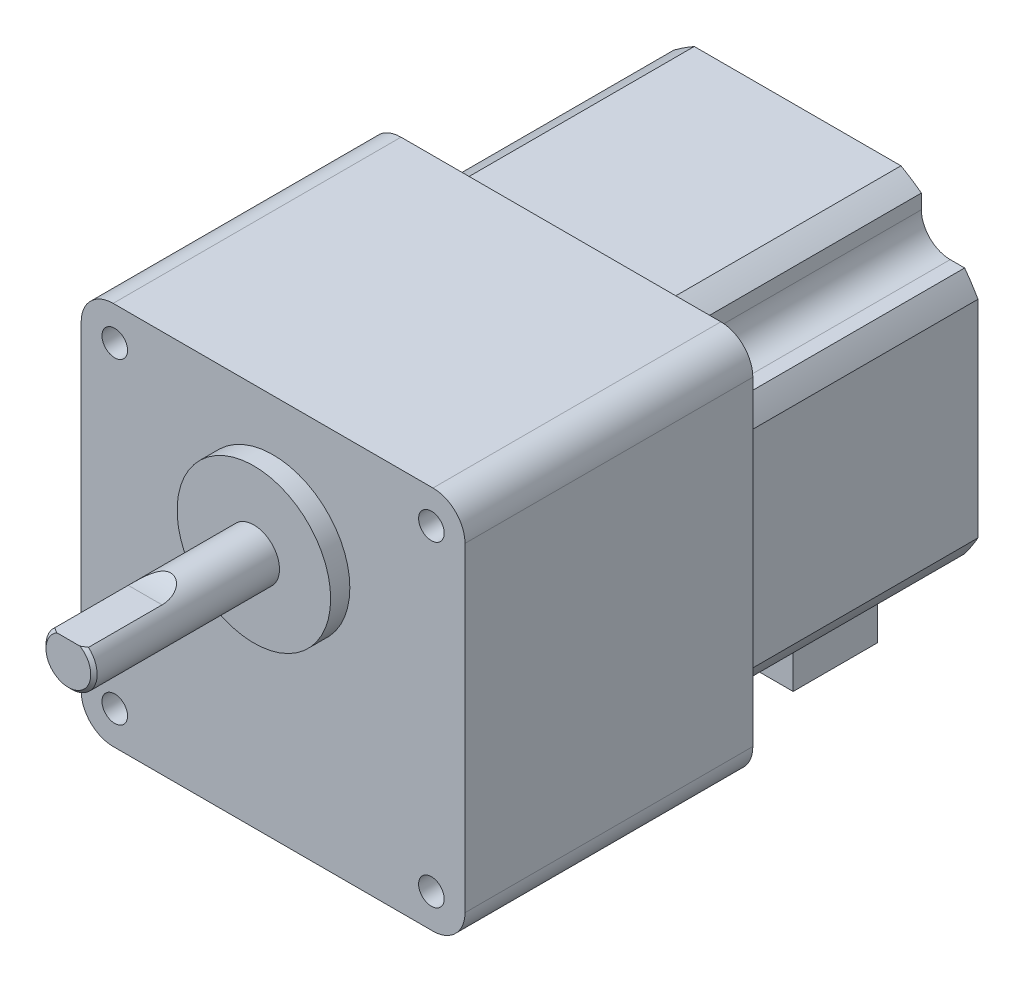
SolidWorks part; units mm, degrees
ref_plane "Front" through (0, 0, 0) normal (0, 0, 1) x (1, 0, 0)
ref_plane "Top" through (0, 0, 0) normal (0, 1, 0) x (1, 0, 0)
ref_plane "Right" through (0, 0, 0) normal (1, 0, 0) x (0, 0, -1)
sketch "Sketch1" plane through (0, 0, 0) normal (0, 0, 1) x (1, 0, 0)
  circle A0 centre (0, 0) radius 12
  dimension "D1" = 24
extrude "Extrude1" add sketch "Sketch1" along normal blind 3
sketch "Sketch2" plane through (0, 0, 3) normal (0, 0, 1) x (1, 0, 0)
  circle A0 centre (0, 0) radius 4
  dimension "D1" = 8
extrude "Extrude2" add sketch "Sketch2" along normal blind 29
chamfer "Chamfer1" distance 0.5 angle 45 1 edges at (4, 0, 32)
sketch "Sketch3" plane through (0, 0, 0) normal (1, 0, 0) x (0, 0, -1)
  line L0 (-32, 3) -> (-20, 3)
  line L1 (-32, 4) -> (-32, -4) construction
  line L2 (-20, 3) -> (-20, 11.5)
  line L3 (-20, 11.5) -> (-32, 11.5)
  line L4 (-32, 11.5) -> (-32, 3)
  line L5 (0, 0) -> (-32, 0) construction
  line L6 (-32, 4) -> (-7.262, 4) construction
  line L7 (-3, 4) -> (-31.5, 4) construction
  line L8 (-16, 4) -> (-16, 0) construction
  circle A0 centre (-20, 11.5) radius 8.5
  dimension "D1" = 3
  dimension "D2" = 12
  dimension "D3" = 16
extrude "Extrude3" cut sketch "Sketch3" against normal mid plane 10 contours A0 L3 L4 L0 | L3 A0 L2 | L2 A0 L3
sketch "Sketch4" plane through (0, 0, 0) normal (0, 0, -1) x (-1, 0, 0)
  line L0 (0, 0) -> (0, -10) construction
  line L1 (-25, -40) -> (25, -40)
  line L2 (-30, -35) -> (-30, 15)
  line L3 (-25, 20) -> (25, 20)
  line L4 (30, -35) -> (30, 15)
  line L5 (-30, -40) -> (30, 20) construction
  line L6 (-30, 20) -> (30, -40) construction
  arc A0 (30, -35) -> (25, -40) centre (25, -35) cw
  arc A1 (-25, -40) -> (-30, -35) centre (-25, -35) cw
  arc A2 (30, 15) -> (25, 20) centre (25, 15) ccw
  arc A3 (-25, 20) -> (-30, 15) centre (-25, 15) ccw
  point P0 (0, -10)
  dimension "D4" = 5
  dimension "D1" = 60
  dimension "D2" = 60
  dimension "D3" = 10
extrude "Extrude4" add sketch "Sketch4" along normal blind 45
sketch "Sketch6" plane through (0, 0, -45) normal (0, 0, -1) x (-1, 0, 0)
  line L0 (-32.5, -10) -> (32.5, -10) construction
  line L3 (0, 22.5) -> (0, -40.337) construction
  line L7 (28.2, -29.35) -> (-28.2, -29.35)
  line L8 (28.2, -29.35) -> (28.2, 9.35)
  line L9 (28.2, 9.35) -> (-28.2, 9.35)
  line L10 (-28.2, -29.35) -> (-28.2, 9.35)
  line L11 (28.2, -29.35) -> (-28.2, 9.35) construction
  line L12 (28.2, 9.35) -> (-28.2, -29.35) construction
  line L13 (-19.35, 18.2) -> (19.35, 18.2)
  line L14 (-19.35, 18.2) -> (-19.35, -38.2)
  line L15 (-19.35, -38.2) -> (19.35, -38.2)
  line L16 (19.35, 18.2) -> (19.35, -38.2)
  line L17 (-19.35, 18.2) -> (19.35, -38.2) construction
  line L18 (-19.35, -38.2) -> (19.35, 18.2) construction
  circle A0 centre (0, -10) radius 32.5
  dimension "D1" = 65
  dimension "D2" = 56.4
  dimension "D3" = 38.7
  dimension "D4" = 38.7
  dimension "D5" = 56.4
  dimension "D6" = 10
extrude "Extrude6" add sketch "Sketch6" along normal blind 37 contours L9 A0 L10 L7 L14 | L16 A0 L13 L14 L9 | L8 A0 L9 L16 L7 | L14 A0 L15 L16 L7 | L16 L9 L14 L7
fillet "Fillet1" radius 4.5 4 edges at (19.35, -29.35, -63.5) (-19.35, -29.35, -63.5) (-19.35, 9.35, -63.5) (19.35, 9.35, -63.5)
sketch "Sketch9" plane through (0, -38.2, 0) normal (0, -1, 0) x (1, 0, 0)
  line L1 (-12.5, -82) -> (12.5, -82)
  line L2 (-12.5, -82) -> (-12.5, -68.8)
  line L3 (-12.5, -68.8) -> (12.5, -68.8)
  line L4 (12.5, -82) -> (12.5, -68.8)
  line L5 (16.1558, -82) -> (-16.1558, -82) construction
  dimension "D1" = 25
  dimension "D2" = 13.2
  dimension "D3" = 12.5
extrude "Extrude9" add sketch "Sketch9" along normal blind 10 separate body
sketch "Sketch10" plane through (0, 0, 0) normal (0, 0, 1) x (1, 0, 0)
  line L1 (-24.7487, 14.7487) -> (24.7487, 14.7487) construction
  line L2 (-24.7487, 14.7487) -> (-24.7487, -34.7487) construction
  line L3 (-24.7487, -34.7487) -> (24.7487, -34.7487) construction
  line L4 (24.7487, 14.7487) -> (24.7487, -34.7487) construction
  line L5 (-24.7487, 14.7487) -> (24.7487, -34.7487) construction
  line L6 (-24.7487, -34.7487) -> (24.7487, 14.7487) construction
  circle A0 centre (0, -10) radius 35 construction
  circle A1 centre (24.7487, 14.7487) radius 2
  circle A2 centre (-24.7487, 14.7487) radius 2
  circle A3 centre (-24.7487, -34.7487) radius 2
  circle A4 centre (24.7487, -34.7487) radius 2
  point P0 (0, -10)
  dimension "D1" = 70
  dimension "D4" = 4
  dimension "D2" = 10
  dimension "D3" = 90
extrude "Extrude10" cut sketch "Sketch10" against normal blind 8
sketch "Sketch11" plane through (0, 0, -82) normal (0, 0, -1) x (-1, 0, 0)
  line L0 (0, -10) -> (0, 0) construction
  circle A0 centre (0, -10) radius 3.175
  dimension "D2" = 6.35
  dimension "D1" = 10
extrude "Extrude11" add sketch "Sketch11" along normal blind 16
chamfer "Chamfer2" distance 1.5 angle 15 1 edges at (-3.175, -10, -98)
sketch "Sketch12" plane through (0, 0, -98) normal (0, 0, -1) x (-1, 0, 0)
  line L1 (-3.5862, -4.1707) -> (4.7187, -4.1707)
  line L2 (-3.5862, -4.1707) -> (-3.5862, -7.375)
  line L3 (-3.5862, -7.375) -> (4.7187, -7.375)
  line L4 (4.7187, -4.1707) -> (4.7187, -7.375)
  circle A0 centre (0, -10) radius 2.7731 construction
  dimension "D1" = 2.625
extrude "Extrude12" cut sketch "Sketch12" against normal blind 15
